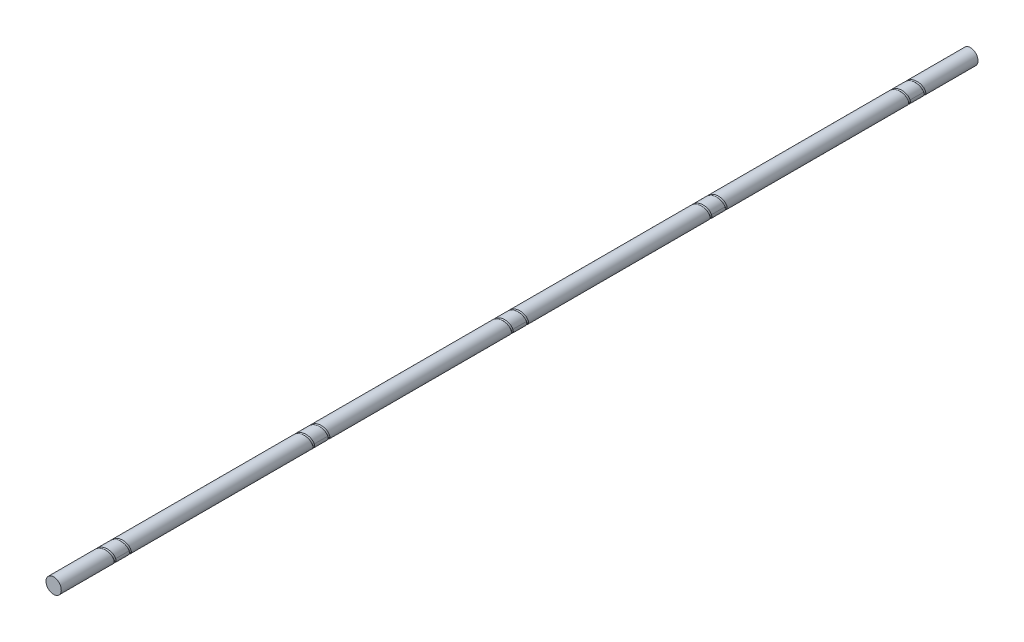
SolidWorks part; units mm, degrees
ref_plane "Front Plane" through (0, 0, 0) normal (0, 0, 1) x (1, 0, 0)
ref_plane "Top Plane" through (0, 0, 0) normal (0, 1, 0) x (1, 0, 0)
ref_plane "Right Plane" through (0, 0, 0) normal (1, 0, 0) x (0, 0, -1)
sketch "Sketch1" plane through (0, 0, 0) normal (0, 0, 1) x (1, 0, 0)
  circle A0 centre (0, 0) radius 25
  dimension "D1" = 50
extrude "Boss-Extrude1" add sketch "Sketch1" along normal blind 3000
ref_plane "Plane1" through (0, 0, 150) normal (0, 0, 1) x (1, 0, 0)
sketch "Sketch2" plane through (0, 0, 150) normal (0, 0, 1) x (1, 0, 0)
  circle A0 centre (0, 0) radius 27.646
  dimension "D1" = 55.292
curve "Helix/Spiral1"
sketch "Sketch3" plane through (0, 0, 0) normal (0, 1, 0) x (1, 0, 0)
  circle A0 centre (-27.646, -150) radius 3.969
  spline S0 degree 3 poles (-27.646, -150) (-27.646, -150.7073) (-26.9833, -152.1286) (-24.0718, -154.2551) (-19.4496, -156.383) (-13.4454, -158.5106) (-6.4857, -160.6383) (0.9349, -162.766) (8.289, -164.8936) (15.0541, -167.0213) (20.7495, -169.1489) (24.9703, -171.2766) (27.4167, -173.4043) (27.9149, -175.5319) (26.4293, -177.6596) (23.0657, -179.7872) (18.063, -181.9149) (11.7766, -184.0426) (4.6535, -186.1702) (-2.8004, -188.2979) (-10.0553, -190.4255) (-16.5956, -192.5532) (-21.9566, -194.6809) (-25.7573, -196.8085) (-27.7277, -198.9362) (-27.7277, -201.0638) (-25.7573, -203.1915) (-21.9566, -205.3191) (-16.5956, -207.4468) (-10.0553, -209.5745) (-2.8004, -211.7021) (4.6535, -213.8298) (11.7766, -215.9574) (18.063, -218.0851) (23.0657, -220.2128) (26.4293, -222.3404) (27.9149, -224.4681) (27.4167, -226.5957) (24.9703, -228.7234) (20.7495, -230.8511) (15.0541, -232.9787) (8.289, -235.1064) (0.9349, -237.234) (-6.4857, -239.3617) (-13.4454, -241.4894) (-19.4496, -243.617) (-24.0718, -245.7449) (-26.9833, -247.8714) (-27.646, -249.2927) (-27.646, -250) knots 0 0 0 0 0.021277 0.042553 0.06383 0.085106 0.106383 0.12766 0.148936 0.170213 0.191489 0.212766 0.234043 0.255319 0.276596 0.297872 0.319149 0.340426 0.361702 0.382979 0.404255 0.425532 0.446809 0.468085 0.489362 0.510638 0.531915 0.553191 0.574468 0.595745 0.617021 0.638298 0.659574 0.680851 0.702128 0.723404 0.744681 0.765957 0.787234 0.808511 0.829787 0.851064 0.87234 0.893617 0.914894 0.93617 0.957447 0.978723 1 1 1 1 construction
  dimension "D1" = 7.938
sweep "Cut-Sweep1" cut profiles "Sketch3" path "Helix/Spiral1"
pattern_linear "LPattern1" count 5 spacing 650 along (0, 0, -1) of "Cut-Sweep1"
